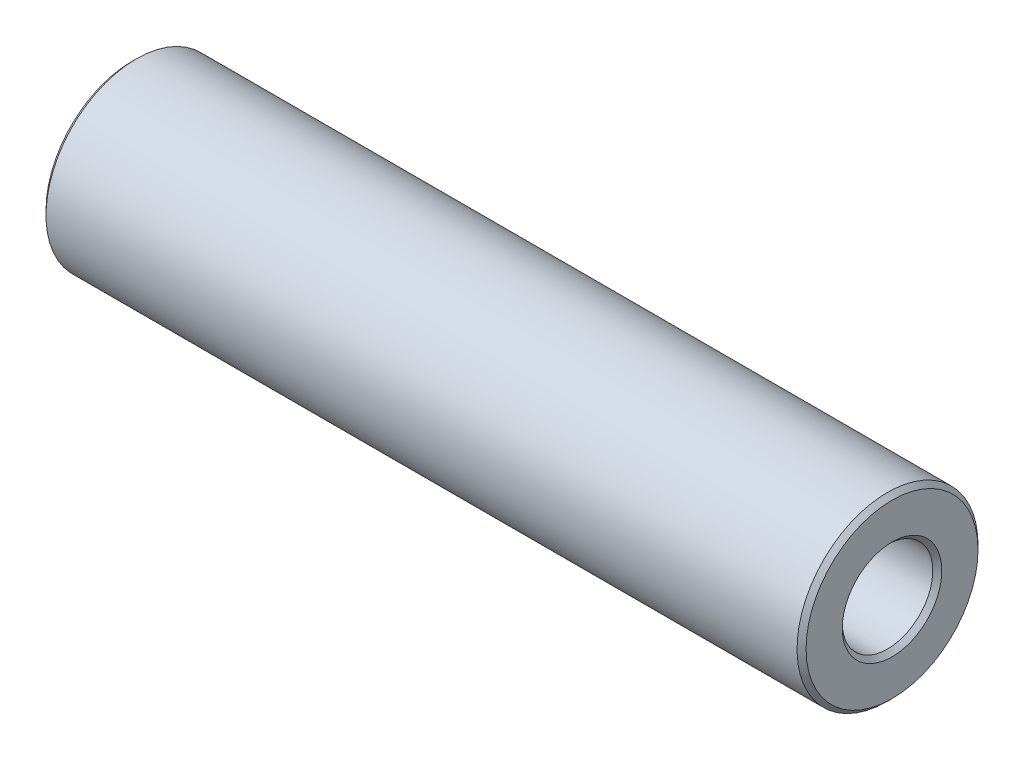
SolidWorks part; units mm, degrees
ref_plane "Front Plane" through (0, 0, 0) normal (0, 0, 1) x (1, 0, 0)
ref_plane "Top Plane" through (0, 0, 0) normal (0, 1, 0) x (1, 0, 0)
ref_plane "Right Plane" through (0, 0, 0) normal (1, 0, 0) x (0, 0, -1)
sketch "Esquisse1" plane through (25, 0, 0) normal (1, 0, 0) x (0, 0, -1)
  circle A0 centre (0, 0) radius 5 construction
  circle A1 centre (0, 0) radius 5
  circle A3 centre (0, 0) radius 10
  dimension "D1" = 20
extrude "Boss.-Extru.1" add sketch "Esquisse1" along normal up to surface (84 mm away)
chamfer "Chanfrein1" distance 0.5 angle 45 4 edges at (109, 0, 5) (25, 5, 0) (25, 10, 0) (109, 0, 10)
